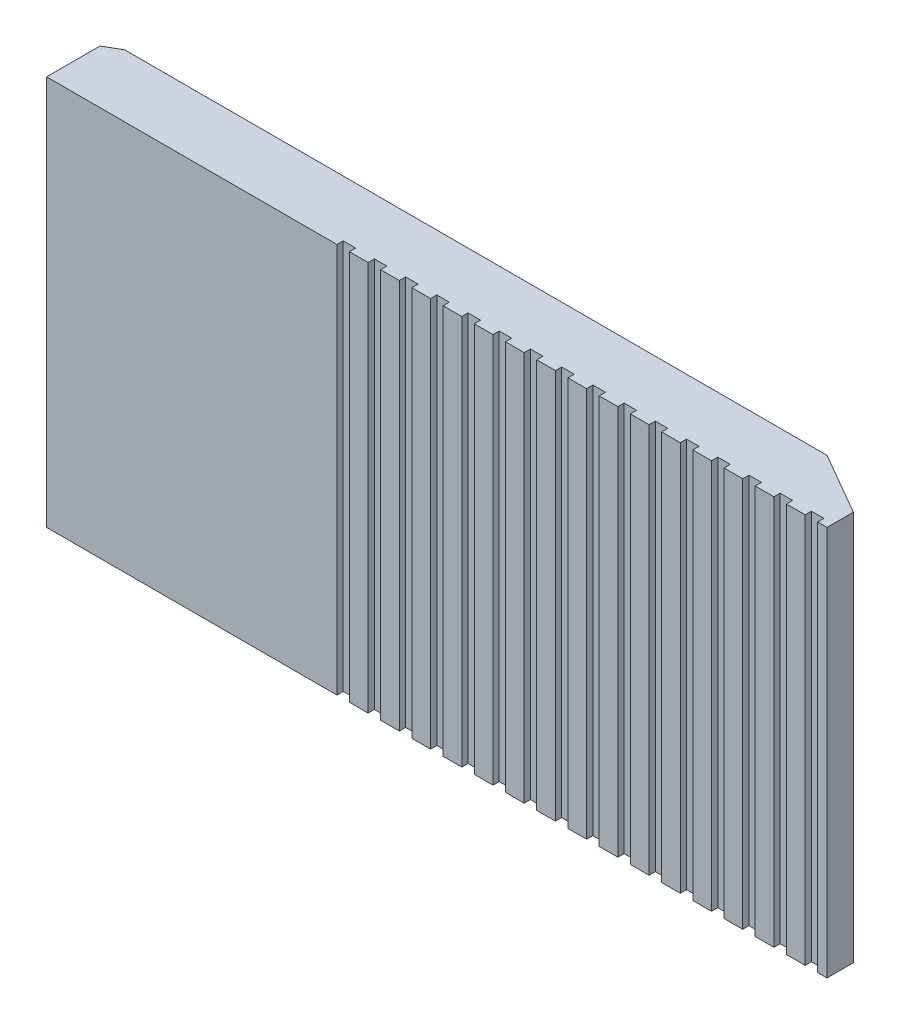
SolidWorks part; units mm, degrees
ref_plane "Płaszczyzna przednia" through (0, 0, 0) normal (0, 0, 1) x (1, 0, 0)
ref_plane "Płaszczyzna górna" through (0, 0, 0) normal (0, 1, 0) x (1, 0, 0)
ref_plane "Płaszczyzna prawa" through (0, 0, 0) normal (1, 0, 0) x (0, 0, -1)
sketch "Szkic1" plane through (0, 0, 0) normal (0, 0, 1) x (1, 0, 0)
  line L1 (-25, 12.5) -> (25, 12.5)
  line L2 (-25, 12.5) -> (-25, -12.5)
  line L3 (-25, -12.5) -> (25, -12.5)
  line L4 (25, 12.5) -> (25, -12.5)
  line L5 (-25, 12.5) -> (0, 0) construction
  line L6 (-25, -12.5) -> (0, 0) construction
  point P0 (0, 0)
  point P6 (9, 0)
  dimension "D1" = 50
  dimension "D4" = 0
  dimension "D5" = 25
  dimension "D6" = 16
extrude "Dodanie-wyciągnięcie1" add sketch "Szkic1" along normal blind 4
chamfer "Sfazowanie1" distance 4 angle 30 1 edges at (25, 0, 0)
sketch "Szkic2" plane through (0, 0, 0) normal (0, 0, -1) x (-1, 0, 0)
  line L0 (-25, -12.5) -> (-25, 12.5) construction
  line L1 (-15, 5) -> (-5, 5)
  line L2 (-15, 5) -> (-15, -5)
  line L3 (-15, -5) -> (-5, -5)
  line L4 (-5, 5) -> (-5, -5)
  line L5 (-15, 5) -> (-5, -5) construction
  line L6 (-15, -5) -> (-5, 5) construction
  point P0 (-10, 0)
  point P5 (-25, 0)
  dimension "D1" = 10
  dimension "D2" = 10
  dimension "D3" = 0
  dimension "D4" = 15
extrude "Dodanie-wyciągnięcie2" add sketch "Szkic2" along normal blind 5.5
sketch "Szkic3" plane through (0, 12.5, 0) normal (0, 1, 0) x (1, 0, 0)
  line L0 (25, -4) -> (-25, -4) construction
  line L1 (23.6, -4.4) -> (24.4, -4.4)
  line L2 (23.6, -4.4) -> (23.6, -3.6)
  line L3 (23.6, -3.6) -> (24.4, -3.6)
  line L4 (24.4, -4.4) -> (24.4, -3.6)
  line L5 (23.6, -4.4) -> (24.4, -3.6) construction
  line L6 (23.6, -3.6) -> (24.4, -4.4) construction
  point P0 (24, -4)
  dimension "D1" = 0.8
  dimension "D2" = 0.8
  dimension "D3" = 1
extrude "Wytnij-wyciągnięcie1" cut sketch "Szkic3" against normal up to next
pattern_linear "Szyk liniowy1" count 16 spacing 2 along (-1, 0, 0) of "Wytnij-wyciągnięcie1"
chamfer "Sfazowanie2" distance 1 angle 30 1 edges at (-25, 0, 0)
